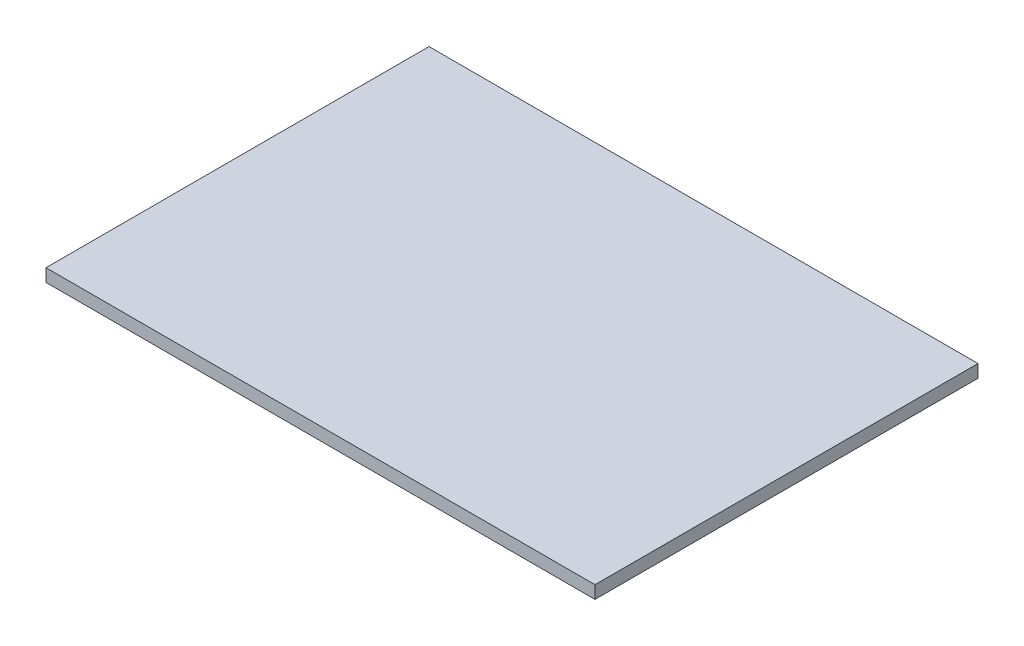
SolidWorks part; units mm, degrees
ref_plane "Front" through (0, 0, 0) normal (0, 0, 1) x (1, 0, 0)
ref_plane "Top" through (0, 0, 0) normal (0, 1, 0) x (1, 0, 0)
ref_plane "Right" through (0, 0, 0) normal (1, 0, 0) x (0, 0, -1)
sketch "Sketch1" plane through (0, 0, 0) normal (0, 1, 0) x (1, 0, 0)
  line L1 (-21.5, -15) -> (21.5, -15)
  line L2 (-21.5, -15) -> (-21.5, 15)
  line L3 (-21.5, 15) -> (21.5, 15)
  line L4 (21.5, -15) -> (21.5, 15)
  line L5 (-21.5, -15) -> (21.5, 15) construction
  line L6 (-21.5, 15) -> (21.5, -15) construction
  point P0 (0, 0)
  dimension "D1" = 43
  dimension "D2" = 30
extrude "Boss-Extrude1" add sketch "Sketch1" along normal mid plane 1
